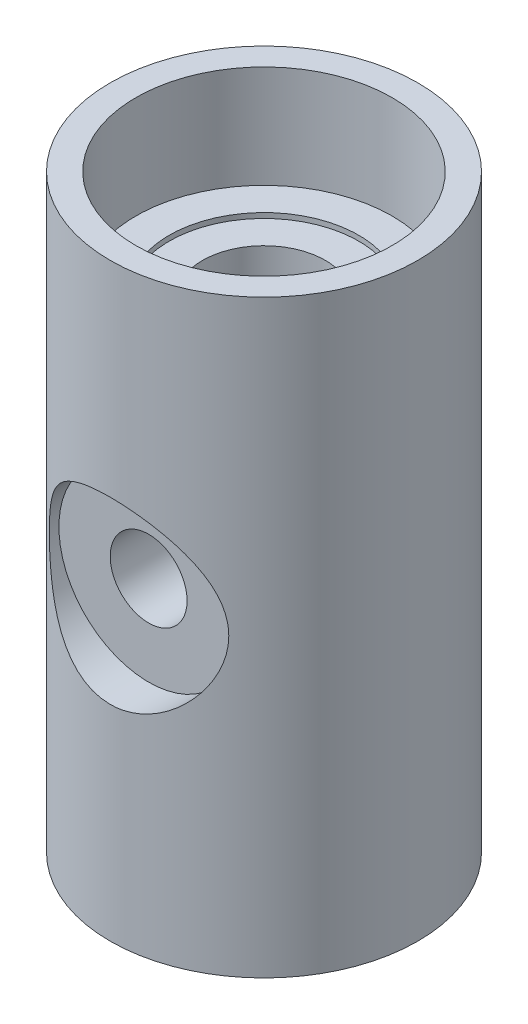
SolidWorks part; units mm, degrees
ref_plane "Front Plane" through (0, 0, 0) normal (0, 0, 1) x (1, 0, 0)
ref_plane "Top Plane" through (0, 0, 0) normal (0, 1, 0) x (1, 0, 0)
ref_plane "Right Plane" through (0, 0, 0) normal (1, 0, 0) x (0, 0, -1)
sketch "Sketch1" plane through (0, 0, 0) normal (0, 1, 0) x (1, 0, 0)
  circle A0 centre (0, 0) radius 6
  dimension "D1" = 12
extrude "Boss-Extrude1" add sketch "Sketch1" along normal mid plane 23 contours A0
sketch "Sketch2" plane through (0, 11.5, 0) normal (0, 1, 0) x (1, 0, 0)
  circle A0 centre (0, 0) radius 2.4
  dimension "D1" = 4.8
extrude "Cut-Extrude1" cut sketch "Sketch2" against normal through all
sketch "Sketch3" plane through (0, 11.5, 0) normal (0, 1, 0) x (1, 0, 0)
  circle A0 centre (0, 0) radius 5
  dimension "D1" = 10
extrude "Cut-Extrude2" cut sketch "Sketch3" against normal blind 4
sketch "Sketch4" plane through (0, 7.5, 0) normal (0, 1, 0) x (1, 0, 0)
  circle A0 centre (0, 0) radius 3.7
  dimension "D1" = 7.4
extrude "Cut-Extrude3" cut sketch "Sketch4" against normal blind 0.2
mirror "Mirror1" about plane through (0, 0, 0) normal (0, 1, 0) of "Cut-Extrude3", "Cut-Extrude2"
sketch "Sketch5" plane through (0, 0, 0) normal (1, 0, 0) x (0, 0, -1)
  line L0 (0, 0) -> (-6, 0) construction
  line L1 (-6, 11.5) -> (-6, -11.5) construction
ref_plane "side-hole plane" through (0, 0, 6) normal (0, 0, 1) x (1, 0, 0)
sketch "Sketch6" plane through (0, 0, 6) normal (0, 0, 1) x (1, 0, 0)
  circle A0 centre (0, 0) radius 1.5
  dimension "D1" = 3
extrude "Cut-Extrude4" cut sketch "Sketch6" against normal blind 5.2
sketch "Sketch7" plane through (0, 0, 6) normal (0, 0, 1) x (1, 0, 0)
  circle A0 centre (0, 0) radius 3.5
  dimension "D1" = 7
extrude "Cut-Extrude5" cut sketch "Sketch7" against normal blind 1.5
